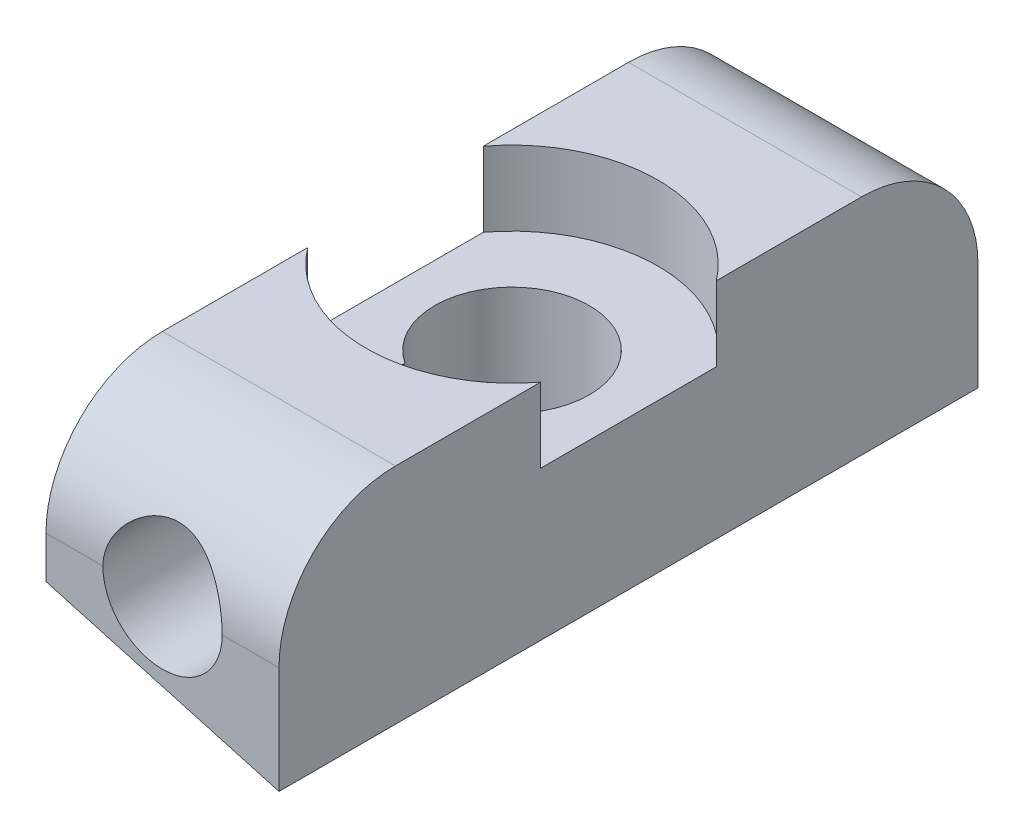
SolidWorks part; units mm, degrees
ref_plane "Plane1" through (0, 0, 0) normal (0, 0, 1) x (1, 0, 0)
ref_plane "Plane2" through (0, 0, 0) normal (0, 1, 0) x (1, 0, 0)
ref_plane "Plane3" through (0, 0, 0) normal (1, 0, 0) x (0, 0, -1)
sketch "Sketch1" plane through (0, 0, 0) normal (0, 0, 1) x (1, 0, 0)
  line L3 (-34.29, 92.8073) -> (-34.29, 98.9033)
  line L4 (-40.64, 94.5853) -> (-40.64, 98.9033)
  line L5 (-40.64, 98.9033) -> (-34.29, 98.9033)
  line L6 (-40.64, 94.5853) -> (-34.29, 92.8073)
  dimension "D1" = 4.318
  dimension "D3" = 6.35
  dimension "D4" = 6.096
extrude "Base-Extrude" add sketch "Sketch1" along normal blind 19.05
ref_plane "back_plane" through (0, 0, 19.05) normal (0, 0, 1) x (1, 0, 0)
fillet "aft_edge" radius 3.175
sketch "Sketch4" plane through (0, 98.9033, 0) normal (0, 1, 0) x (-1, 0, 0)
  line L1 (34.29, 0) -> (40.64, 0) construction
  line L2 (34.29, 15.875) -> (34.29, 0) construction
  circle A0 centre (37.465, 9.525) radius 2.1082
  dimension "D1" = 4.2164
  dimension "D2" = 9.525
  dimension "D3" = 3.175
extrude "thru" cut sketch "Sketch4" against normal through all
sketch "Sketch5" plane through (0, 98.9033, 0) normal (0, 1, 0) x (-1, 0, 0)
  circle A0 centre (37.465, 9.525) radius 3.9751
  dimension "D1" = 7.9502
extrude "cbore" cut sketch "Sketch5" against normal blind 2.032
sketch "Sketch3" plane through (0, 0, 19.05) normal (0, 0, 1) x (1, 0, 0)
  line L0 (-40.64, 98.9033) -> (-40.64, 95.7283) construction
  line L2 (-34.29, 92.8073) -> (-34.29, 95.7283) construction
  line L3 (-40.64, 98.9033) -> (-34.29, 98.9033) construction
  circle A1 centre (-37.465, 95.7283) radius 1.6256
  dimension "D1" = 3.175
  dimension "D3" = 3.175
  dimension "D2" = 3.2512
extrude "slot" cut sketch "Sketch3" against normal up to next
fillet "Fillet1" radius 3.175
